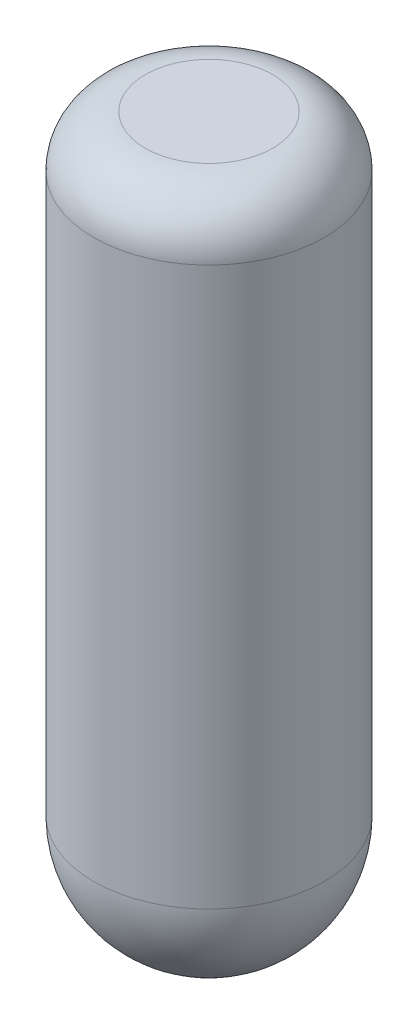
SolidWorks part; units mm, degrees
ref_plane "Front Plane" through (0, 0, 0) normal (0, 0, 1) x (1, 0, 0)
ref_plane "Top Plane" through (0, 0, 0) normal (0, 1, 0) x (1, 0, 0)
ref_plane "Right Plane" through (0, 0, 0) normal (1, 0, 0) x (0, 0, -1)
sketch "Sketch1" plane through (0, 0, 0) normal (0, 0, 1) x (1, 0, 0)
  line L0 (0, 67.5728) -> (0, -63.7552) construction
  line L1 (68.6425, 324.0857) -> (68.6425, -7.8169)
  line L2 (37.9581, 354.7701) -> (0, 354.7701)
  line L3 (0, 354.7701) -> (0, -76.4594)
  arc A0 (68.6425, 324.0857) -> (37.9581, 354.7701) centre (37.9581, 324.0857) ccw
  arc A1 (68.6425, -7.8169) -> (0, -76.4594) centre (0, -7.8169) cw
revolve "Revolve1" add sketch "Sketch1" angle 360 about L0
